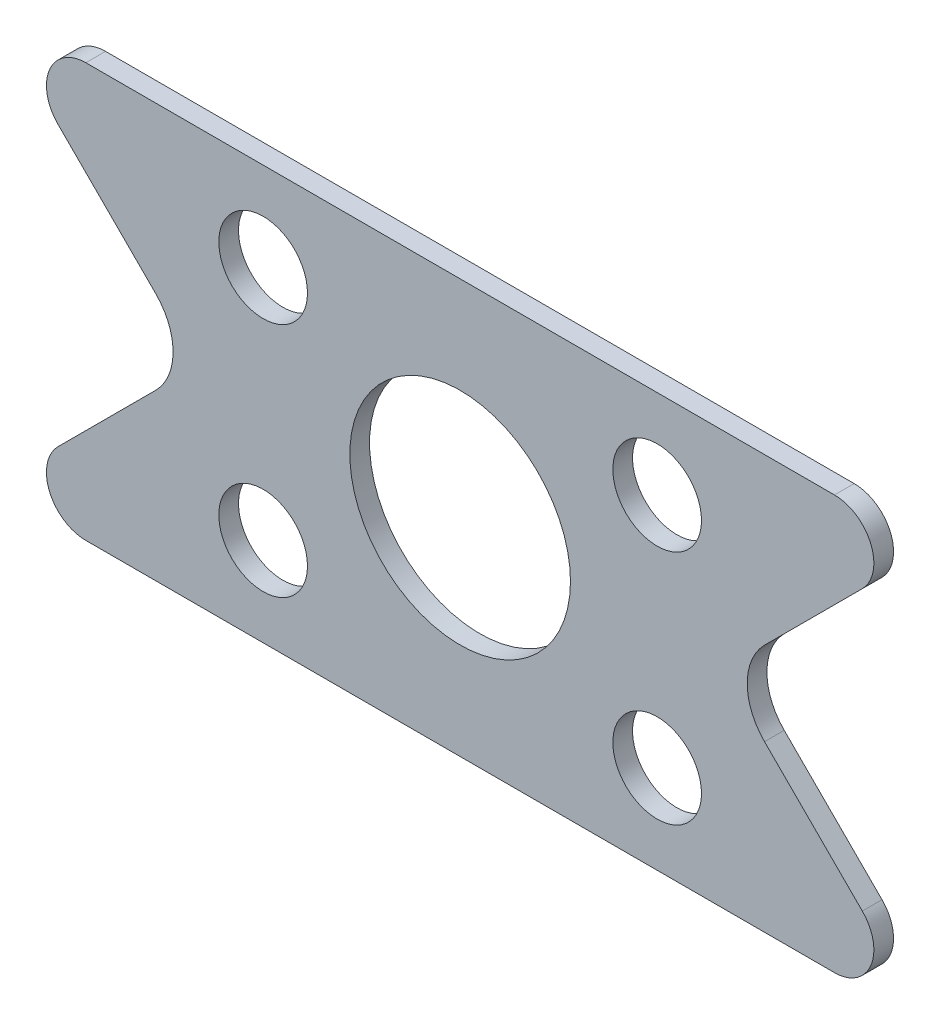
SolidWorks part; units mm, degrees
ref_plane "Plan de face" through (0, 0, 0) normal (0, 0, 1) x (1, 0, 0)
ref_plane "Plan de dessus" through (0, 0, 0) normal (0, 1, 0) x (1, 0, 0)
ref_plane "Plan de droite" through (0, 0, 0) normal (1, 0, 0) x (0, 0, -1)
sketch "Esquisse1" plane through (0, 0, 0) normal (0, 0, 1) x (1, 0, 0)
  line L1 (-210, -105) -> (210, -105)
  line L2 (-210, -105) -> (-210, 105)
  line L3 (-210, 105) -> (210, 105)
  line L4 (210, -105) -> (210, 105)
  circle A0 centre (0, 0) radius 56
  circle A1 centre (100, 60) radius 22.5
  circle A2 centre (100, -60) radius 22.5
  circle A3 centre (-100, -60) radius 22.5
  circle A4 centre (-100, 60) radius 22.5
  point P4 (0, 105)
  point P6 (-210, 0)
  dimension "D3" = 112
  dimension "D5" = 200
  dimension "D8" = 45
  dimension "D1" = 420
  dimension "D2" = 210
  dimension "D4" = 100
  dimension "D6" = 60
  dimension "D7" = 120
extrude "Extrusion1" add sketch "Esquisse1" along normal blind 10
sketch "Esquisse2" plane through (0, 0, 10) normal (0, 0, 1) x (1, 0, 0)
  line L0 (210, 105) -> (-210, 105) construction
  line L1 (210, -105) -> (210, 105) construction
  line L2 (-210, -105) -> (210, -105) construction
  line L3 (-43.9839, 0) -> (223.1434, 0) construction
  line L4 (204.1421, 70.8579) -> (154.4975, 21.2132)
  line L5 (154.4975, -21.2132) -> (204.1421, -70.8579)
  line L6 (190, 105) -> (232.8152, 105)
  line L7 (190, -105) -> (232.8152, -105)
  line L8 (232.8152, -105) -> (232.8152, 105)
  arc A0 (204.1421, 70.8579) -> (190, 105) centre (190, 85) ccw
  arc A1 (190, -105) -> (204.1421, -70.8579) centre (190, -85) ccw
  arc A2 (154.4975, 21.2132) -> (154.4975, -21.2132) centre (175.7107, 0) ccw
  point P16 (133.2843, 0)
  dimension "D1" = 40
  dimension "D2" = 40
  dimension "D5" = 30
  dimension "D3" = 45
  dimension "D4" = 45
extrude "Enlèv. mat.-Extru.1" cut sketch "Esquisse2" against normal blind 10
mirror "Symétrie1" about plane through (0, 0, 0) normal (1, 0, 0) of "Enlèv. mat.-Extru.1"
